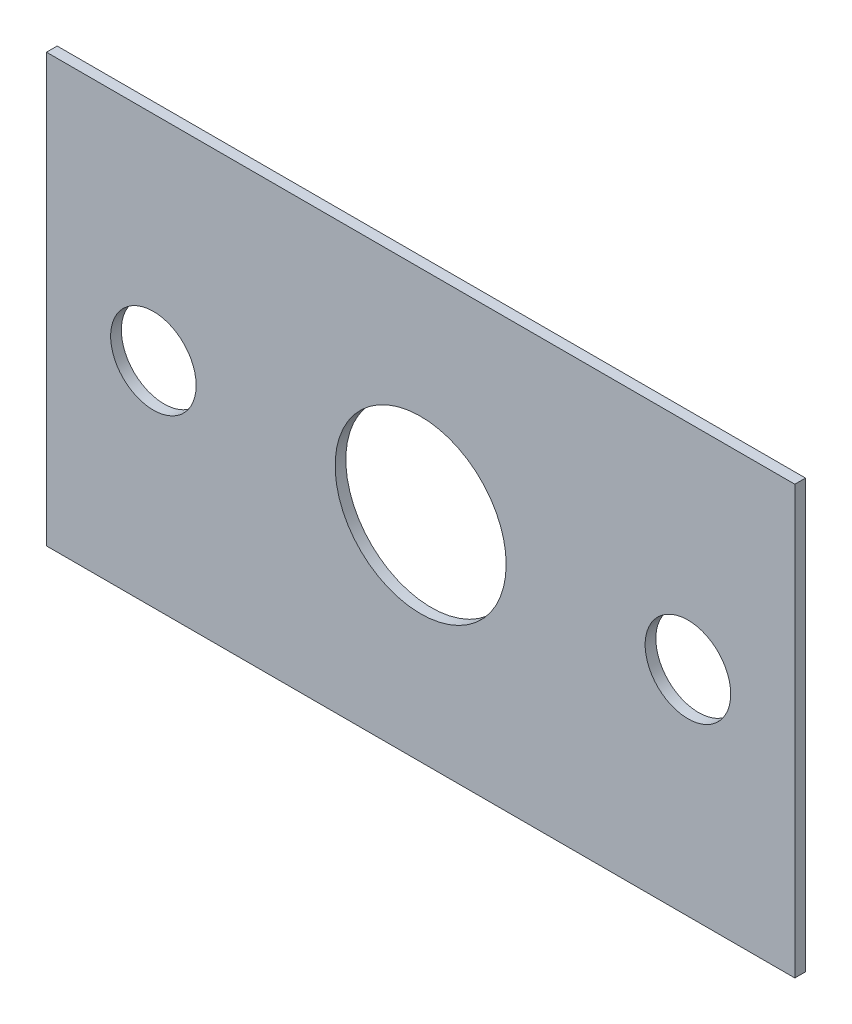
SolidWorks part; units mm, degrees
ref_plane "Alzado" through (0, 0, 0) normal (0, 0, 1) x (1, 0, 0)
ref_plane "Planta" through (0, 0, 0) normal (0, 1, 0) x (1, 0, 0)
ref_plane "Vista lateral" through (0, 0, 0) normal (1, 0, 0) x (0, 0, -1)
sketch "Croquis1" plane through (0, 0, 0) normal (0, 0, 1) x (1, 0, 0)
  line L1 (-35, 20) -> (35, 20)
  line L2 (-35, 20) -> (-35, -20)
  line L3 (-35, -20) -> (35, -20)
  line L4 (35, 20) -> (35, -20)
  circle A0 centre (0, 0) radius 8
  circle A1 centre (-25, 0) radius 4
  circle A2 centre (25, 0) radius 4
extrude "Extruir1" add sketch "Croquis1" along normal blind 1
